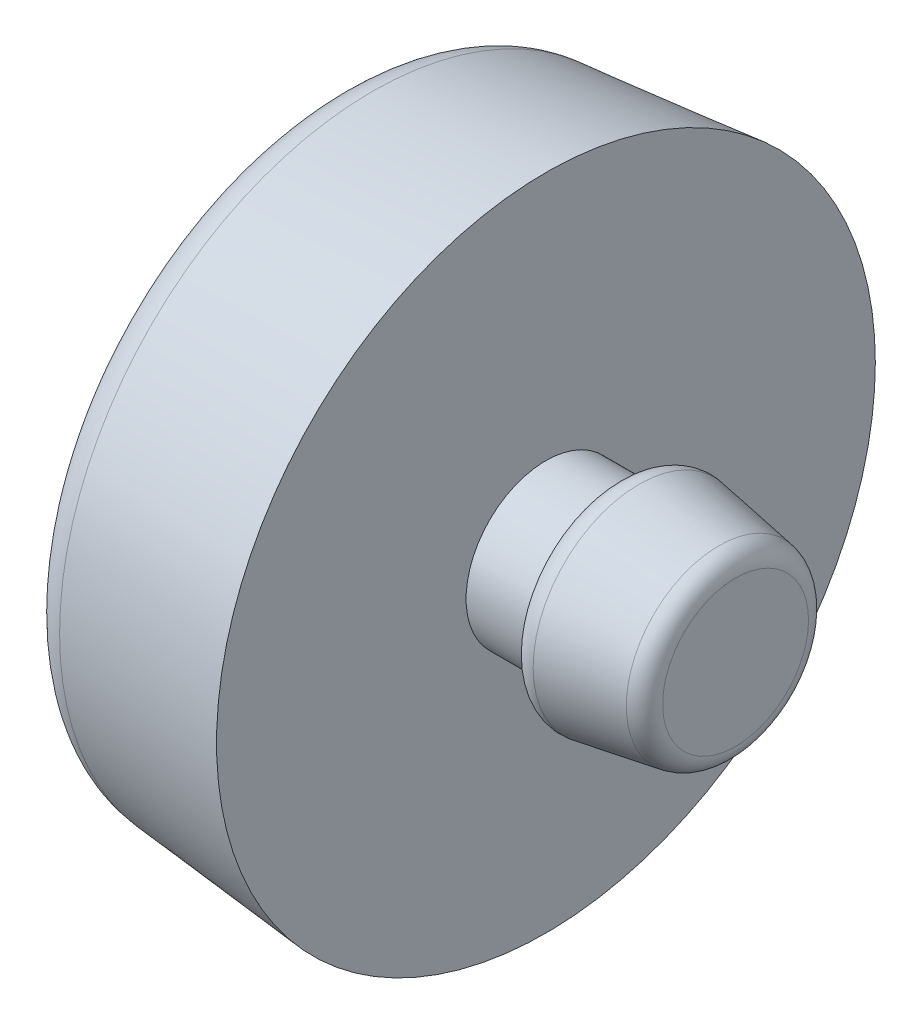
SolidWorks part; units mm, degrees
ref_plane "Plan1" through (0, 0, 0) normal (0, 0, 1) x (1, 0, 0)
ref_plane "Plan2" through (0, 0, 0) normal (0, 1, 0) x (1, 0, 0)
ref_plane "Plan3" through (0, 0, 0) normal (1, 0, 0) x (0, 0, -1)
sketch "Esquisse1" plane through (0, 0, 0) normal (0, 0, 1) x (1, 0, 0)
  line L0 (57, 0) -> (-50, 0) construction
  line L1 (-11, 0) -> (-11, 15.5)
  line L2 (-11, 15.5) -> (-0.5, 16.5)
  line L3 (-0.5, 16.5) -> (-0.5, 4)
  line L4 (-0.5, 4) -> (3, 4)
  line L5 (3, 4) -> (3, 5.5)
  line L6 (3, 5.5) -> (9, 4.5)
  line L7 (9, 4.5) -> (9, 0)
  line L8 (9, 0) -> (-11, 0)
  dimension "D1" = 15.5
  dimension "D2" = 16.5
  dimension "D3" = 10.5
  dimension "D4" = 6
  dimension "D5" = 20
  dimension "D6" = 4
  dimension "D7" = 5.5
  dimension "D8" = 4.5
revolve "Base-Révolution" add sketch "Esquisse1" angle 360 about L0
fillet "Congé1" radius 1
fillet "Congé2" radius 2
